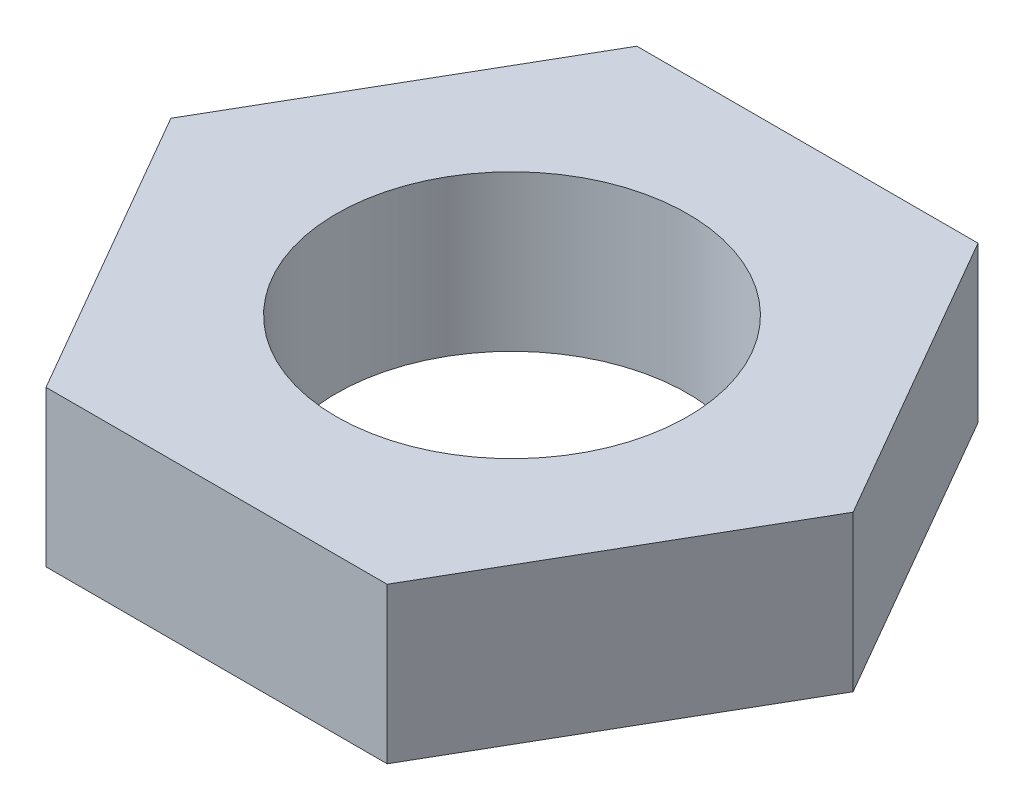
SolidWorks part; units mm, degrees
ref_plane "Plan de face" through (0, 0, 0) normal (0, 0, 1) x (1, 0, 0)
ref_plane "Plan de dessus" through (0, 0, 0) normal (0, 1, 0) x (1, 0, 0)
ref_plane "Plan de droite" through (0, 0, 0) normal (1, 0, 0) x (0, 0, -1)
sketch "Esquisse1" plane through (0, 0, 0) normal (0, 1, 0) x (1, 0, 0)
  line L1 (5.4848, -9.5) -> (10.9697, 0)
  line L2 (10.9697, 0) -> (5.4848, 9.5)
  line L3 (5.4848, 9.5) -> (-5.4848, 9.5)
  line L4 (-5.4848, 9.5) -> (-10.9697, 0)
  line L5 (-10.9697, 0) -> (-5.4848, -9.5)
  line L6 (-5.4848, -9.5) -> (5.4848, -9.5)
  circle A0 centre (0, 0) radius 9.5 construction
  circle A1 centre (0, 0) radius 5.65
  dimension "D2" = 11.3
  dimension "D1" = 19
extrude "Extrusion1" add sketch "Esquisse1" along normal blind 5
